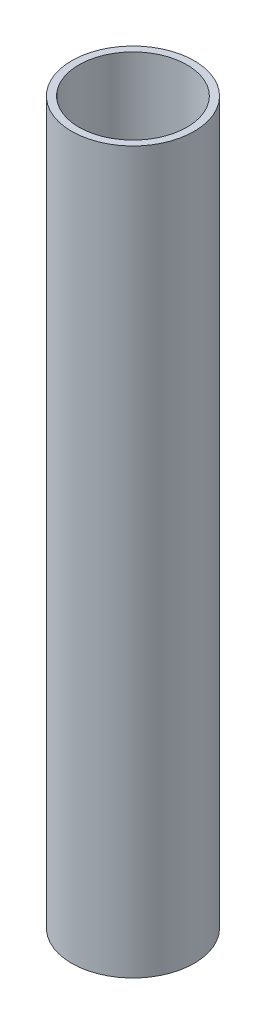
SolidWorks part; units mm, degrees
ref_plane "Front Plane" through (0, 0, 0) normal (0, 0, 1) x (1, 0, 0)
ref_plane "Top Plane" through (0, 0, 0) normal (0, 1, 0) x (1, 0, 0)
ref_plane "Right Plane" through (0, 0, 0) normal (1, 0, 0) x (0, 0, -1)
sketch "Sketch1" plane through (0, 0, 0) normal (0, 1, 0) x (1, 0, 0)
  circle A0 centre (0, 0) radius 8.5
  circle A1 centre (0, 0) radius 7.5
  dimension "D1" = 17
  dimension "D2" = 15
extrude "Boss-Extrude1" add sketch "Sketch1" along normal blind 100
